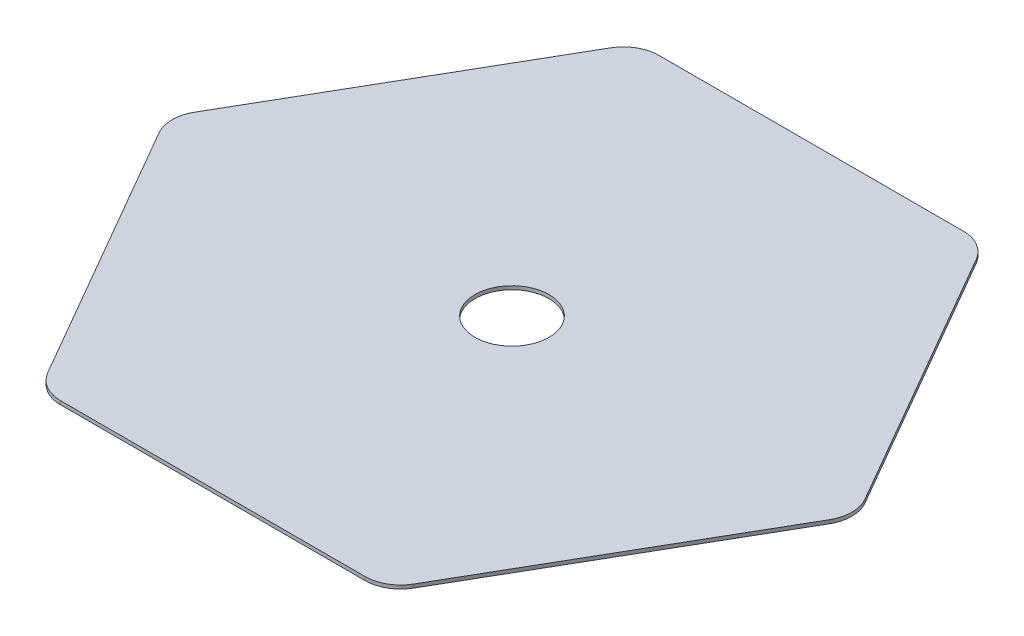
SolidWorks part; units mm, degrees
ref_plane "Front Plane" through (0, 0, 0) normal (0, 0, 1) x (1, 0, 0)
ref_plane "Top Plane" through (0, 0, 0) normal (0, 1, 0) x (1, 0, 0)
ref_plane "Right Plane" through (0, 0, 0) normal (1, 0, 0) x (0, 0, -1)
sketch "Sketch2" plane through (0, 0, 0) normal (0, 1, 0) x (1, 0, 0)
  line L1 (-153.9793, 0) -> (-76.9897, -133.35)
  line L2 (-76.9897, -133.35) -> (76.9897, -133.35)
  line L3 (76.9897, -133.35) -> (153.9793, 0)
  line L4 (153.9793, 0) -> (76.9897, 133.35)
  line L5 (76.9897, 133.35) -> (-76.9897, 133.35)
  line L6 (-76.9897, 133.35) -> (-153.9793, 0)
  circle A0 centre (0, 0) radius 133.35 construction
extrude "Extrude1" add sketch "Sketch2" along normal blind 1.5875
fillet "Fillet1" radius 15.875 6 edges at (-76.9897, 0.7937, 133.35) (76.9897, 0.7937, 133.35) (153.9793, 0.7937, 0) (76.9897, 0.7937, -133.35) (-76.9897, 0.7937, -133.35) (-153.9793, 0.7937, 0)
hole_wizard "1/4 Clearance Hole1" positions "3DSketch1" profile "Sketch3" hole size "1/4" standard "Ansi Inch"
sketch3d "3DSketch1"
  point P0 (0, 0, 0)
  point P3 (0, 0, 0)
sketch "Sketch3" plane through (0, 0, 0) normal (1, 0, 0) x (0, 0, -1)
  line L0 (0, 0) -> (0, 6.35)
  line L1 (0, 6.35) -> (16.51, 6.35)
  line L2 (16.51, 6.35) -> (16.51, 0)
  line L5 (16.51, 0) -> (0, 0)
  line L10 (0, 6.35) -> (-16.51, 6.35) construction
  line L11 (0, -6.35) -> (0, 107.95) construction
  dimension "Hole Dia." = 33.02
  dimension "Hole Depth" = 6.35
  dimension "Drill Angle" = 180
